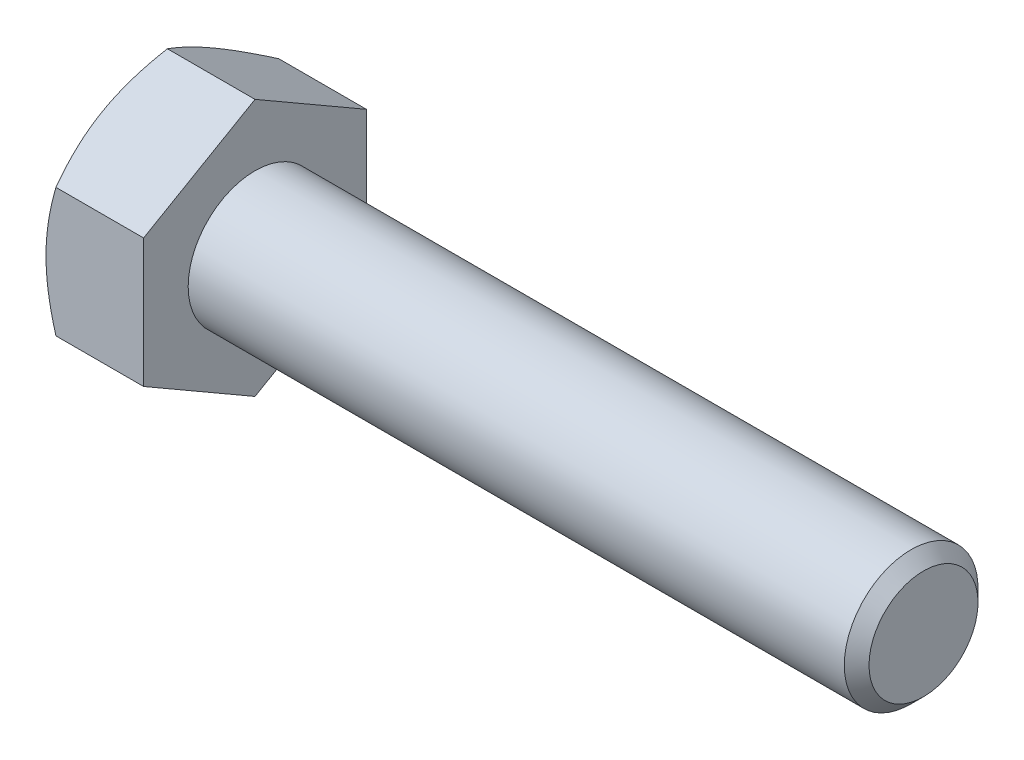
SolidWorks part; units mm, degrees
ref_plane "Plane1" through (0, 0, 0) normal (0, 0, 1) x (1, 0, 0)
ref_plane "Plane2" through (0, 0, 0) normal (0, 1, 0) x (1, 0, 0)
ref_plane "Plane3" through (0, 0, 0) normal (1, 0, 0) x (0, 0, -1)
extrude "BaseHead" add sketch "Sketch1" along normal blind 4.38
sketch "Sketch1" plane through (0, 0, 0) normal (1, 0, 0) x (0, 0, -1)
  line L0 (5, 2.8868) -> (5, -2.8868)
  line L1 (-5, 2.8868) -> (-5, -2.8868)
  line L2 (5, -2.8868) -> (0, -5.7735)
  line L3 (0, -5.7735) -> (-5, -2.8868)
  line L4 (5, 2.8868) -> (0, 5.7735)
  line L5 (0, 5.7735) -> (-5, 2.8868)
  dimension "Width_flats" = 10
  dimension "D2" = 120
  dimension "D3" = 5
  dimension "D4" = 5
  dimension "D5" = 5
revolve "BaseBody" add sketch "BodySke"
sketch "BodySke" plane through (0, 0, 0) normal (0, 0, 1) x (1, 0, 0)
  line L0 (0, 2.8868) -> (0, -2.8868) construction
  line L1 (0, 0) -> (34.38, 0)
  line L2 (0, 0) -> (0, 3)
  line L3 (0, 3) -> (33.8255, 3)
  line L4 (34.38, 0) -> (34.38, 2.4455)
  line L5 (4.38, 5.7735) -> (4.38, 2.8868) construction
  line L6 (34.38, 2.4455) -> (33.8255, 3)
  line L7 (0, 0) -> (96.52, 0) construction
  line L8 (34.38, -2.4455) -> (33.8255, -3) construction
  line L9 (0, -3) -> (33.8255, -3) construction
  line L10 (5.38, 15.24) -> (5.38, -1.27) construction
  line L11 (4.38, 15.24) -> (4.38, -1.27) construction
  line L12 (4.38, 2.8868) -> (4.38, -2.8868) construction
  dimension "Length" = 30
  dimension "Body_ch_ang" = 45
  dimension "Diameter" = 6
  dimension "Minor_dia" = 4.891
  dimension "Advance" = 1
  dimension "Thread_nom" = 30
fillet "HeadFillet" radius 0.25
sketch "Sketch3" plane through (0, 0, 0) normal (0, 0, 1) x (1, 0, 0)
  line L0 (0, 5) -> (3.3333, 10.7735)
  line L1 (0, 5.7735) -> (0, 2.8868) construction
  line L2 (3.3333, 10.7735) -> (3.3333, 15.7735)
  line L3 (3.3333, 15.7735) -> (-10, 15.7735)
  line L4 (-10, 15.7735) -> (-10, 5)
  line L5 (-10, 5) -> (0, 5)
  line L6 (0, 0) -> (99.06, 0) construction
  line L7 (4.38, 5.7735) -> (0, 5.7735) construction
  dimension "D1" = 5
  dimension "D2" = 5
  dimension "D3" = 10
  dimension "D4" = 5
  dimension "Head_ch_ang" = 30
revolve "HeadChamfer" cut sketch "Sketch3" angle 360 about L6
sketch "ThdSchSke" plane through (0, 0, 0) normal (0, 0, 1) x (1, 0, 0)
  line L0 (5.38, -2.4455) -> (4.9917, -3)
  line L1 (5.38, -2.4455) -> (5.7683, -3)
  line L2 (5.7683, -3) -> (5.7683, -3.75)
  line L3 (-3.175, 0) -> (5.1513, 0) construction
  line L5 (5.7683, -3.75) -> (4.9917, -3.75)
  line L6 (4.9917, -3.75) -> (4.9917, -3)
  dimension "Thread_minor" = 4.891
  dimension "Diameter" = 6
  dimension "Start" = 5.38
  dimension "SideAngle" = 55
  dimension "VeeAngle" = 70
  dimension "Overcut" = 7.5
revolve "ThreadSchematic" cut sketch "ThdSchSke" angle 360 about L3
pattern_linear "ThdSchPat"
equation "\"D3@Sketch1\" = \"Width_flats@Sketch1\" / 2"
equation "\"D4@Sketch1\" = \"D3@Sketch1\""
equation "\"D5@Sketch1\" = \"D4@Sketch1\""
equation "\"Thread_minor@ThreadCosmetic\" = \"Minor_dia@BodySke\""
equation "\"D1@Sketch3\" = \"Width_flats@Sketch1\" / 2"
equation "' \"D1@Sketch4\" = \"Width_flats@Sketch1\""
equation "\"Thread_length@ThreadCosmetic\" = ((sgn( (\"Length@BodySke\" - \"Advance@BodySke\" ) - \"Thread_nom@BodySke\" )-1)*( (\"Length@BodySke\" - \"Advance@BodySke\" ) - \"Thread_nom@BodySke\" ))/-2+ \"Thread_nom@BodySke\""
equation "\"Thread_minor@ThdSchSke\" = \"Minor_dia@BodySke\""
equation "\"Diameter@ThdSchSke\" = \"Diameter@BodySke\""
equation "\"Overcut@ThdSchSke\" = \"Diameter@BodySke\" * 1.25"
equation "\"Start@ThdSchSke\" = \"Head_ht@BaseHead\" + \"Length@BodySke\" - \"Thread_length@ThreadCosmetic\"  '---Non-countersunk---"
equation "\"Num_threads@ThdSchPat\" = int( \"Thread_length@ThreadCosmetic\" / \"Advance@BodySke\" + 0.999 )  + 1"
equation "\"Advance@ThdSchPat\" = \"Thread_length@ThreadCosmetic\" /  (\"Num_threads@ThdSchPat\" - 1) 'relax it"
equation "\"Num_threads@ThdSchPat\" = \"Num_threads@ThdSchPat\" - sgn( \"Num_threads@ThdSchPat\" - 1) '---chamfered tips only---"
